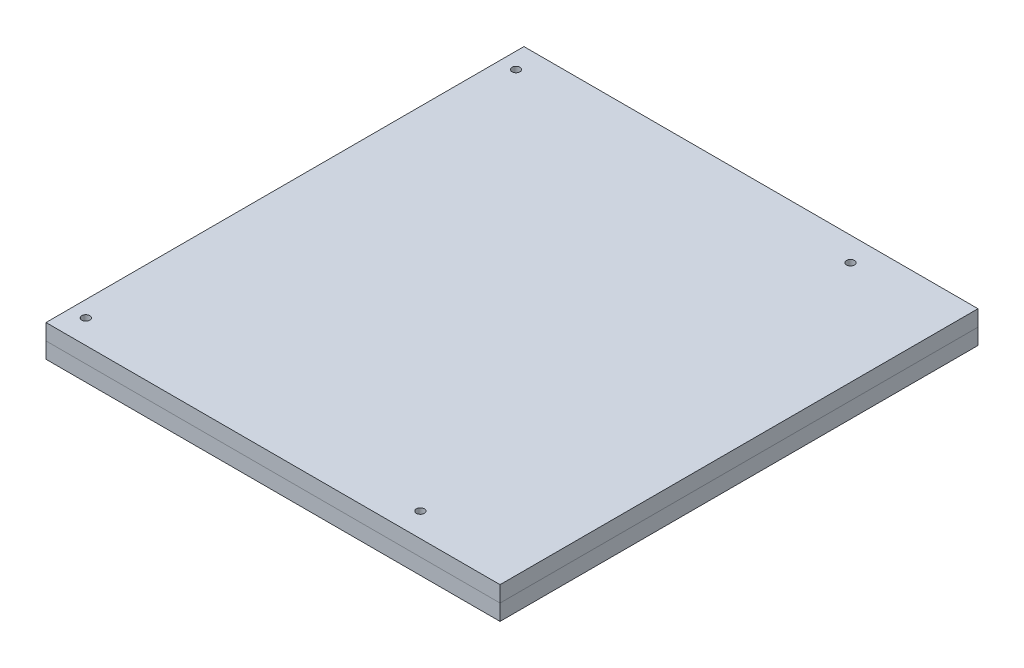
SolidWorks part; units mm, degrees
ref_plane "Front Plane" through (0, 0, 0) normal (0, 0, 1) x (1, 0, 0)
ref_plane "Top Plane" through (0, 0, 0) normal (0, 1, 0) x (1, 0, 0)
ref_plane "Right Plane" through (0, 0, 0) normal (1, 0, 0) x (0, 0, -1)
sketch "Sketch1" plane through (0, 0, 0) normal (0, 1, 0) x (1, 0, 0)
  line L1 (0, 0) -> (171, 0)
  line L2 (0, 0) -> (0, -180)
  line L3 (0, -180) -> (171, -180)
  line L4 (171, 0) -> (171, -180)
extrude "Boss-Extrude1" add sketch "Sketch1" along normal blind 6
sketch "Sketch2" plane through (0, 6, 0) normal (0, 1, 0) x (1, 0, 0)
  line L1 (0, 0) -> (171, 0)
  line L2 (0, 0) -> (0, -180)
  line L3 (0, -180) -> (171, -180)
  line L4 (171, 0) -> (171, -180)
extrude "Boss-Extrude2" add sketch "Sketch2" along normal blind 6 separate body
sketch "Sketch3" plane through (0, 12, 0) normal (0, 1, 0) x (1, 0, 0)
  line L0 (171, 0) -> (0, 0) construction
  line L1 (0, 0) -> (0, -180) construction
  line L4 (0, -90) -> (171, -90) construction
  line L5 (171, -180) -> (171, 0) construction
  circle A0 centre (6, -9) radius 1.5
  circle A4 centre (132, -9) radius 1.5
  circle A5 centre (132, -171) radius 1.5
  circle A6 centre (6, -171) radius 1.5
extrude "Cut-Extrude1" cut sketch "Sketch3" against normal through all
equation "\"sheetThickness\"=0.63mm"
equation "\"flange\"= 11mm"
equation "\"baffleCutWidth\"= 28.58mm"
equation "\"baffleCutLength\"= 146.22mm"
equation "\"metalLength\" = 156.28mm"
equation "\"metalWidth\" = 35.5mm"
equation "\"pitch\" = 42mm"
equation "\"cabDepth\" = 130mm "
equation "\"overallDepth\" = \"cabDepth\" + 58mm   "
equation "\"D1@Sketch1\"=4*\"pitch\"+3"
equation "\"D1@Sketch3\"=6+3"
equation "\"D2@Sketch3\"=3+3"
equation "\"D4@Sketch3\"=\"pitch\" -3"
